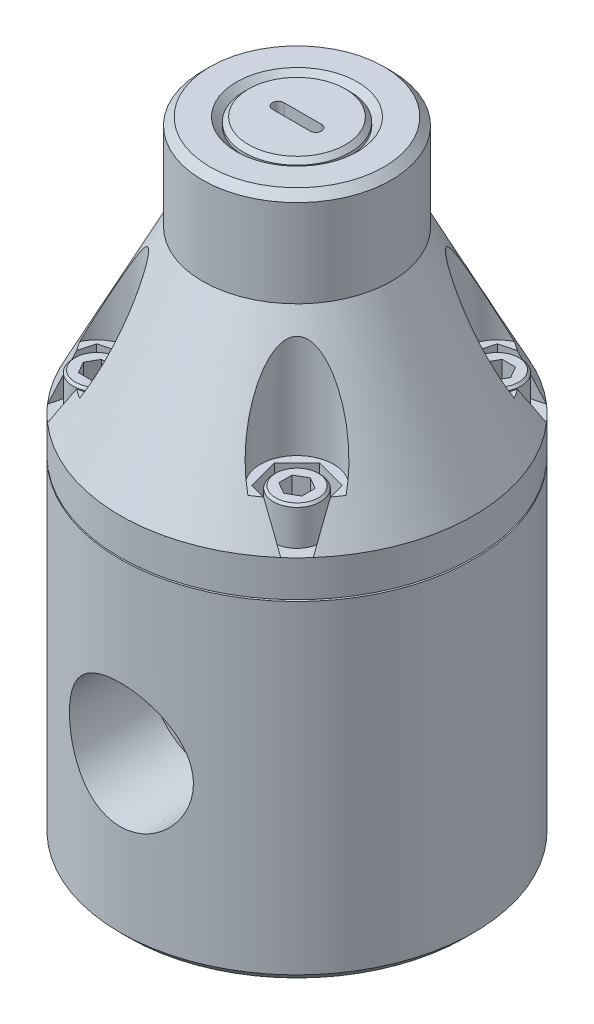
SolidWorks part; units mm, degrees
ref_plane "Front Plane" through (0, 0, 0) normal (0, 0, 1) x (1, 0, 0)
ref_plane "Top Plane" through (0, 0, 0) normal (0, 1, 0) x (1, 0, 0)
ref_plane "Right Plane" through (0, 0, 0) normal (1, 0, 0) x (0, 0, -1)
sketch "Sketch1" plane through (0, 0, 0) normal (0, 1, 0) x (1, 0, 0)
  circle A0 centre (0, 0) radius 29.718
  dimension "D1" = 59.436
extrude "Extrude1" add sketch "Sketch1" along normal blind 105.41
sketch "Sketch2" plane through (0, 0, 0) normal (0, 0, 1) x (1, 0, 0)
  line L0 (0, 0) -> (0, 105.41) construction
  line L1 (29.718, 105.41) -> (-29.718, 105.41) construction
  line L2 (-29.718, 55.88) -> (-20.6255, 55.88)
  line L3 (-29.718, 105.41) -> (-29.718, 0) construction
  line L4 (-20.6255, 55.88) -> (-20.6255, 56.134)
  line L5 (-20.6255, 56.134) -> (-29.718, 56.134)
  line L6 (-29.718, 56.134) -> (-29.718, 62.23)
  line L7 (-29.718, 62.23) -> (-15.875, 89.408)
  line L8 (-15.875, 89.408) -> (-15.875, 105.41)
  line L9 (-15.875, 105.41) -> (-21.1252, 108.0842)
  line L10 (-21.1252, 108.0842) -> (-34.3087, 108.0842)
  line L11 (-34.3087, 108.0842) -> (-34.3087, 59.0996)
  line L12 (-34.3087, 59.0996) -> (-29.718, 55.88)
  line L13 (-29.718, 0) -> (29.718, 0) construction
  dimension "D1" = 55.88
  dimension "D2" = 0.254
  dimension "D3" = 29.718
  dimension "D4" = 6.35
  dimension "D5" = 27.178
  dimension "D6" = 15.875
revolve "Cut-Revolve1" cut sketch "Sketch2" angle 360 about L0
ref_plane "Plane1" through (0, 105.41, 0) normal (0, 1, 0) x (-1, 0, 0)
sketch "Sketch3" plane through (0, 105.41, 0) normal (0, 1, 0) x (-1, 0, 0)
  circle A0 centre (0, 0) radius 10.16
  dimension "D1" = 20.32
extrude "Extrude2" cut sketch "Sketch3" against normal blind 1.27 draft 45
ref_plane "Plane2" through (0, 0, 29.718) normal (0, 0, 1) x (1, 0, 0)
sketch "Sketch4" plane through (0, 0, 29.718) normal (0, 0, 1) x (1, 0, 0)
  line L0 (0, 0) -> (0, 55.88) construction
  line L1 (29.718, 55.88) -> (-29.718, 55.88) construction
  line L2 (29.718, 27.432) -> (-29.718, 27.432) construction
  line L6 (29.718, 0) -> (29.718, 55.88) construction
  line L7 (-29.718, 55.88) -> (-29.718, 0) construction
  line L8 (-29.718, 0) -> (29.718, 0) construction
  dimension "D1" = 27.432
hole_wizard "1/2 Rc Tapped Hole1" positions "3DSketch1" profile "Sketch5" size "1/2" standard "BSI"
sketch3d "3DSketch1"
  line L0 (29.718, 27.432, 29.718) -> (-29.718, 27.432, 29.718) construction
  point P0 (0, 27.432, 29.718)
  point P5 (0, 27.432, 29.718)
sketch "Sketch5" plane through (0, 27.432, 29.718) normal (1, 0, 0) x (0, -1, 0)
  line L0 (0, 0) -> (0, 27.7544)
  line L1 (8.75, 24.13) -> (0, 27.7544)
  line L2 (-8.75, 24.13) -> (0, 27.7544) construction
  line L3 (8.75, 24.13) -> (8.75, 14.986)
  line L4 (8.75, 14.986) -> (10.0093, 14.986)
  line L5 (10.0093, 14.986) -> (10.4771, 0)
  line L6 (-10.0093, 14.986) -> (-10.4771, 0) construction
  line L7 (10.4771, 0) -> (0, 0)
  line L8 (0, -6.35) -> (0, 107.95) construction
  line L11 (-8.75, 14.986) -> (-10.0093, 14.986) construction
  dimension "Tap Drill Dia." = 17.5
  dimension "Tap Drill Depth" = 24.13
  dimension "Thread Dia." = 20.9541
  dimension "Thread Angle" = 3.576
  dimension "Thread Depth" = 14.986
  dimension "Drill Angle" = 135
pattern_circular "CirPattern1" count 2 over 360 about axis through (0, 105.41, 0) along (0, -1, 0) of "1/2 Rc Tapped Hole1"
chamfer "Chamfer1" distance 1.27 angle 45 1 edges at (0, 105.41, -15.875)
chamfer "Chamfer2" distance 1.524 angle 45 1 edges at (0, 0, 29.718)
sketch "Sketch6" plane through (0, 105.41, 0) normal (0, 1, 0) x (-1, 0, 0)
  circle A0 centre (0, 0) radius 8.89
extrude "Extrude3" add sketch "Sketch6" against normal up to surface (1.27 mm away)
chamfer "Chamfer3" distance 0.762 angle 45 1 edges at (0, 105.41, 8.89)
sketch "Sketch7" plane through (0, 105.41, 0) normal (0, 1, 0) x (-1, 0, 0)
  line L0 (0, 0) -> (-3.175, 0) construction
  line L1 (-3.175, 0.9652) -> (3.175, 0.9652)
  line L2 (3.175, -0.9652) -> (-3.175, -0.9652)
  arc A0 (-3.175, 0.9652) -> (-3.175, -0.9652) centre (-3.175, 0) ccw
  arc A1 (3.175, -0.9652) -> (3.175, 0.9652) centre (3.175, 0) ccw
  dimension "D1" = 3.175
  dimension "D2" = 6.35
  dimension "D3" = 0.9652
  dimension "D4" = 0.9652
extrude "Extrude4" cut sketch "Sketch7" against normal blind 4.7498
ref_plane "Plane3" through (0, 68.58, 0) normal (0, 1, 0) x (-1, 0, 0)
sketch "Sketch8" plane through (0, 68.58, 0) normal (0, 1, 0) x (-1, 0, 0)
  line L0 (0, 0) -> (0, -29.718) construction
  line L1 (0, 0) -> (-21.0138, -21.0138) construction
  circle A1 centre (0, 0) radius 29.718 construction
  circle A2 centre (0, 0) radius 23.8125 construction
  circle A3 centre (-16.838, -16.838) radius 6.1722
  dimension "D2" = 47.625
  dimension "D3" = 12.3444
  dimension "D1" = 45
extrude "Extrude5" cut sketch "Sketch8" along normal blind 21.0058
pattern_circular "CirPattern2" count 4 over 360 about axis through (0, 0, 0) along (0, 1, 0) of "Extrude5"
sketch "Sketch9" plane through (0, 68.58, 0) normal (0, 1, 0) x (-1, 0, 0)
  line L0 (0, 0) -> (0, -29.718) construction
  line L1 (0, 0) -> (-21.0138, -21.0138) construction
  line L2 (-16.838, -16.838) -> (-21.0138, -12.6622) construction
  line L5 (-20.6332, -13.0427) -> (-23.298, -23.298)
  line L7 (-13.0427, -20.6332) -> (-11.6536, -15.4488)
  line L8 (-11.6536, -15.4488) -> (-15.4488, -11.6536)
  line L9 (-15.4488, -11.6536) -> (-20.6332, -13.0427)
  line L10 (-22.0224, -18.2271) -> (-18.2271, -22.0224)
  line L11 (-23.298, -23.298) -> (-13.0427, -20.6332)
  line L13 (-20.6332, -13.0427) -> (-22.0224, -18.2271)
  line L14 (-18.2271, -22.0224) -> (-13.0427, -20.6332)
  circle A0 centre (0, 0) radius 29.718 construction
  circle A1 centre (0, 0) radius 23.8125 construction
  circle A2 centre (-16.838, -16.838) radius 4.6482 construction
  circle A3 centre (-16.838, -16.838) radius 4.6482 construction
  dimension "D1" = 9.2964
extrude "Extrude6" cut sketch "Sketch9" against normal blind 6.35
pattern_circular "CirPattern3" count 4 over 360 about axis through (0, 0, 0) along (0, 1, 0) of "Extrude6"
sketch "Sketch10" plane through (0, 68.58, 0) normal (0, 1, 0) x (-1, 0, 0)
  circle A0 centre (-16.838, -16.838) radius 3.9624
  dimension "D1" = 7.9248
extrude "Extrude7" add sketch "Sketch10" against normal up to surface (6.35 mm away)
sketch "Sketch11" plane through (0, 68.58, 0) normal (0, 1, 0) x (-1, 0, 0)
  line L1 (-19.0755, -16.838) -> (-17.9568, -18.7758)
  line L2 (-17.9568, -18.7758) -> (-15.7192, -18.7758)
  line L3 (-15.7192, -18.7758) -> (-14.6004, -16.838)
  line L4 (-14.6004, -16.838) -> (-15.7192, -14.9002)
  line L5 (-15.7192, -14.9002) -> (-17.9568, -14.9002)
  line L6 (-17.9568, -14.9002) -> (-19.0755, -16.838)
  circle A0 centre (-16.838, -16.838) radius 1.9378 construction
extrude "Extrude8" cut sketch "Sketch11" against normal blind 3.175
pattern_circular "CirPattern4" count 4 over 360 about axis through (0, 0, 0) along (0, 1, 0) of "Extrude7", "Extrude8"
chamfer "Chamfer5" distance 0.381 angle 45 4 edges at (16.838, 68.58, -12.8756) (12.8756, 68.58, 16.838) (-16.838, 68.58, 12.8756) (-12.8756, 68.58, -16.838)
